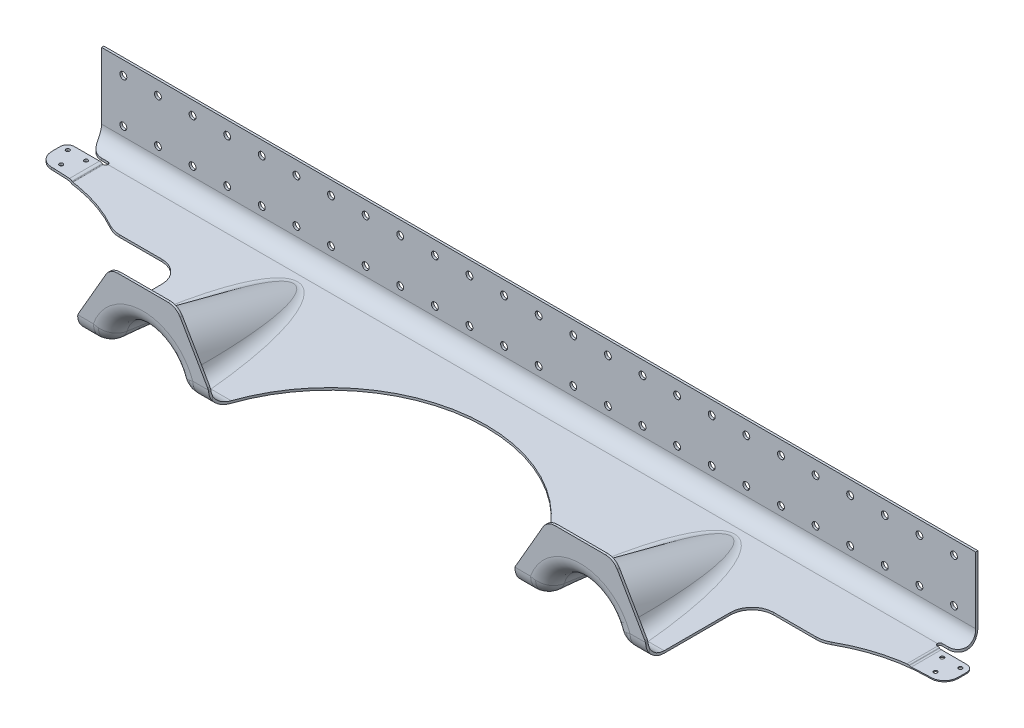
SolidWorks part; units mm, degrees
ref_plane "Front Plane" through (0, 0, 0) normal (1, 0, 0) x (0, 1, 0)
ref_plane "Top Plane" through (0, 0, 0) normal (0, 0, 1) x (0, 1, 0)
ref_plane "Right Plane" through (0, 0, 0) normal (0, 1, 0) x (-1, 0, 0)
sketch "sk 5dia hole pat" plane through (0, 0, 0) normal (0, 0, 1) x (0, 1, 0)
  line L4 (-30.48, -48.26) -> (30.48, -48.26) construction
  point P3 (0, -48.26)
  circle B0 centre (30.48, -579.12) radius 4.826
  circle B1 centre (1188.72, 579.12) radius 4.826
  circle B2 centre (78.74, -579.12) radius 4.826
  circle B3 centre (127, -579.12) radius 4.826
  circle B4 centre (175.26, -579.12) radius 4.826
  circle B5 centre (223.52, -579.12) radius 4.826
  circle B6 centre (271.78, -579.12) radius 4.826
  circle B7 centre (320.04, -579.12) radius 4.826
  circle B8 centre (368.3, -579.12) radius 4.826
  circle B9 centre (416.56, -579.12) radius 4.826
  circle B10 centre (464.82, -579.12) radius 4.826
  circle B11 centre (513.08, -579.12) radius 4.826
  circle B12 centre (561.34, -579.12) radius 4.826
  circle B13 centre (609.6, -579.12) radius 4.826
  circle B14 centre (657.86, -579.12) radius 4.826
  circle B15 centre (706.12, -579.12) radius 4.826
  circle B16 centre (754.38, -579.12) radius 4.826
  circle B17 centre (802.64, -579.12) radius 4.826
  circle B18 centre (850.9, -579.12) radius 4.826
  circle B19 centre (899.16, -579.12) radius 4.826
  circle B20 centre (947.42, -579.12) radius 4.826
  circle B21 centre (995.68, -579.12) radius 4.826
  circle B22 centre (1043.94, -579.12) radius 4.826
  circle B23 centre (1092.2, -579.12) radius 4.826
  circle B24 centre (1140.46, -579.12) radius 4.826
  circle B25 centre (1188.72, -579.12) radius 4.826
  circle B26 centre (30.48, -530.86) radius 4.826
  circle B27 centre (30.48, -482.6) radius 4.826
  circle B28 centre (30.48, -434.34) radius 4.826
  circle B29 centre (30.48, -386.08) radius 4.826
  circle B30 centre (30.48, -337.82) radius 4.826
  circle B31 centre (30.48, -289.56) radius 4.826
  circle B32 centre (30.48, -241.3) radius 4.826
  circle B33 centre (30.48, -193.04) radius 4.826
  circle B34 centre (30.48, -144.78) radius 4.826
  circle B35 centre (30.48, -96.52) radius 4.826
  circle B36 centre (30.48, -48.26) radius 4.826
  circle B37 centre (30.48, 0) radius 4.826
  circle B38 centre (30.48, 48.26) radius 4.826
  circle B39 centre (30.48, 96.52) radius 4.826
  circle B40 centre (30.48, 144.78) radius 4.826
  circle B41 centre (30.48, 193.04) radius 4.826
  circle B42 centre (30.48, 241.3) radius 4.826
  circle B43 centre (30.48, 289.56) radius 4.826
  circle B44 centre (30.48, 337.82) radius 4.826
  circle B45 centre (30.48, 386.08) radius 4.826
  circle B46 centre (30.48, 434.34) radius 4.826
  circle B47 centre (30.48, 482.6) radius 4.826
  circle B48 centre (30.48, 530.86) radius 4.826
  circle B49 centre (30.48, 579.12) radius 4.826
  circle B50 centre (1140.46, 579.12) radius 4.826
  circle B51 centre (1092.2, 579.12) radius 4.826
  circle B52 centre (1043.94, 579.12) radius 4.826
  circle B53 centre (995.68, 579.12) radius 4.826
  circle B54 centre (947.42, 579.12) radius 4.826
  circle B55 centre (899.16, 579.12) radius 4.826
  circle B56 centre (850.9, 579.12) radius 4.826
  circle B57 centre (802.64, 579.12) radius 4.826
  circle B58 centre (754.38, 579.12) radius 4.826
  circle B59 centre (706.12, 579.12) radius 4.826
  circle B60 centre (657.86, 579.12) radius 4.826
  circle B61 centre (609.6, 579.12) radius 4.826
  circle B62 centre (561.34, 579.12) radius 4.826
  circle B63 centre (513.08, 579.12) radius 4.826
  circle B64 centre (464.82, 579.12) radius 4.826
  circle B65 centre (416.56, 579.12) radius 4.826
  circle B66 centre (368.3, 579.12) radius 4.826
  circle B67 centre (320.04, 579.12) radius 4.826
  circle B68 centre (271.78, 579.12) radius 4.826
  circle B69 centre (223.52, 579.12) radius 4.826
  circle B70 centre (175.26, 579.12) radius 4.826
  circle B71 centre (127, 579.12) radius 4.826
  circle B72 centre (78.74, 579.12) radius 4.826
  circle B73 centre (1188.72, 530.86) radius 4.826
  circle B74 centre (1188.72, 482.6) radius 4.826
  circle B75 centre (1188.72, 434.34) radius 4.826
  circle B76 centre (1188.72, 386.08) radius 4.826
  circle B77 centre (1188.72, 337.82) radius 4.826
  circle B78 centre (1188.72, 289.56) radius 4.826
  circle B79 centre (1188.72, 241.3) radius 4.826
  circle B80 centre (1188.72, 193.04) radius 4.826
  circle B81 centre (1188.72, 144.78) radius 4.826
  circle B82 centre (1188.72, 96.52) radius 4.826
  circle B83 centre (1188.72, 48.26) radius 4.826
  circle B84 centre (1188.72, 0) radius 4.826
  circle B85 centre (1188.72, -48.26) radius 4.826
  circle B86 centre (1188.72, -96.52) radius 4.826
  circle B87 centre (1188.72, -144.78) radius 4.826
  circle B88 centre (1188.72, -193.04) radius 4.826
  circle B89 centre (1188.72, -241.3) radius 4.826
  circle B90 centre (1188.72, -289.56) radius 4.826
  circle B91 centre (1188.72, -337.82) radius 4.826
  circle B92 centre (1188.72, -386.08) radius 4.826
  circle B93 centre (1188.72, -434.34) radius 4.826
  circle B94 centre (1188.72, -482.6) radius 4.826
  circle B95 centre (1188.72, -530.86) radius 4.826
  line B96 (609.6, -579.12) -> (609.6, -504.12) construction
  line B97 (30.48, 0) -> (105.48, 0) construction
  circle B98 centre (-30.48, 579.12) radius 4.826
  circle B99 centre (-175.26, -579.12) radius 4.826
  circle B100 centre (-127, -579.12) radius 4.826
  circle B101 centre (-30.48, -579.12) radius 4.826
  circle B102 centre (-1188.72, 96.52) radius 4.826
  circle B103 centre (-127, 579.12) radius 4.826
  circle B104 centre (-464.82, 579.12) radius 4.826
  circle B105 centre (-513.08, 579.12) radius 4.826
  circle B106 centre (-706.12, 579.12) radius 4.826
  circle B107 centre (-754.38, 579.12) radius 4.826
  circle B108 centre (-899.16, 579.12) radius 4.826
  circle B109 centre (-30.48, 530.86) radius 4.826
  circle B110 centre (-30.48, 482.6) radius 4.826
  circle B111 centre (-30.48, 434.34) radius 4.826
  circle B112 centre (-30.48, 386.08) radius 4.826
  circle B113 centre (-30.48, 337.82) radius 4.826
  circle B114 centre (-30.48, 289.56) radius 4.826
  circle B115 centre (-30.48, 241.3) radius 4.826
  circle B116 centre (-30.48, 193.04) radius 4.826
  circle B117 centre (-30.48, 144.78) radius 4.826
  circle B118 centre (-30.48, 96.52) radius 4.826
  circle B119 centre (-30.48, 48.26) radius 4.826
  circle B120 centre (-30.48, 0) radius 4.826
  circle B121 centre (-30.48, -48.26) radius 4.826
  circle B122 centre (-30.48, -96.52) radius 4.826
  circle B123 centre (-30.48, -144.78) radius 4.826
  circle B124 centre (-30.48, -241.3) radius 4.826
  circle B125 centre (-30.48, -289.56) radius 4.826
  circle B126 centre (-30.48, -337.82) radius 4.826
  circle B127 centre (-30.48, -386.08) radius 4.826
  circle B128 centre (-30.48, -434.34) radius 4.826
  circle B129 centre (-30.48, -482.6) radius 4.826
  circle B130 centre (-30.48, -530.86) radius 4.826
  line B131 (-1188.72, 0) -> (-1113.72, 0) construction
  dimension "D1" = 60.96
sketch_block_instance "5dia hole pat-1"
sketch_block "5dia hole pat" parameters "D1"=9.652, "D2"=9.652, "D3"=75
sketch_block_instance "5dia hole pat-2"
sketch "sk 47.986in pnl" plane through (0, 0, 0) normal (0, 0, 1) x (0, 1, 0)
  line B0 (0.1778, 0) -> (1219.0222, 0) construction
  line B1 (0.1778, 609.4222) -> (1219.0222, 609.4222)
  line B2 (0.1778, 609.4222) -> (0.1778, -609.4222)
  line B3 (0.1778, -609.4222) -> (1219.0222, -609.4222)
  line B4 (1219.0222, 609.4222) -> (1219.0222, -609.4222)
  line B5 (609.6, 609.4222) -> (609.6, -609.4222) construction
  dimension "D1" = 30.3022
sketch_block_instance "47.986in pnl-1"
sketch_block "47.986in pnl" parameters "D1"=1218.8444, "D2"=1218.8444
sketch "sk main body" plane through (0, 0, 0) normal (1, 0, 0) x (0, 1, 0)
  line L0 (49.53, 0) -> (-43.18, 0)
  line L1 (-68.58, 25.4) -> (-68.58, 224.6)
  line L2 (-43.18, 250) -> (34.925, 250)
  line L3 (-26.67, 279.6901) -> (-26.67, 213.0698) construction
  line L4 (49.53, 3.175) -> (-43.18, 3.175)
  line L5 (-65.405, 25.4) -> (-65.405, 224.6)
  line L6 (-43.18, 246.825) -> (34.925, 246.825)
  line L7 (34.925, 250) -> (34.925, 246.825)
  line L8 (49.53, 3.175) -> (49.53, 0)
  line L9 (55, 0) -> (-55, 0) construction
  arc A0 (-43.18, 0) -> (-68.58, 25.4) centre (-43.18, 25.4) cw
  arc A1 (-68.58, 224.6) -> (-43.18, 250) centre (-43.18, 224.6) cw
  arc A2 (-43.18, 3.175) -> (-65.405, 25.4) centre (-43.18, 25.4) cw
  arc A3 (-65.405, 224.6) -> (-43.18, 246.825) centre (-43.18, 224.6) cw
  dimension "D2" = 25.4
  dimension "D1" = 19.05
  dimension "D3" = 12.7
  dimension "D4" = 16.51
  dimension "D5" = 61.595
  dimension "D7" = 243.65
  dimension "D6" = 3.175
extrude "main body" add sketch "sk main body" along normal mid plane 1218.8444
sketch "sk upper holes" plane through (0, 0, 250) normal (0, 0, 1) x (1, 0, 0)
  line L0 (-609.4222, 0.1778) -> (-609.4222, 1219.0222) construction
  line L1 (609.4222, 0.1778) -> (609.4222, 1219.0222) construction
  line L2 (609.4222, 34.925) -> (-609.4222, 34.925) construction
  circle A2 centre (-342.9, 15.875) radius 16.51 construction
  circle A3 centre (-266.7, 15.875) radius 16.51 construction
  circle A4 centre (266.7, 15.875) radius 16.51 construction
  circle A5 centre (342.9, 15.875) radius 16.51 construction
  line B0 (-342.9, 15.875) -> (-266.7, 15.875) construction
  circle B1 centre (-342.9, 15.875) radius 7.1438
  circle B2 centre (-266.7, 15.875) radius 7.1438
  line B3 (266.7, 15.875) -> (342.9, 15.875) construction
  circle B4 centre (266.7, 15.875) radius 7.1438
  circle B5 centre (342.9, 15.875) radius 7.1438
  dimension "D1" = 304.8
  dimension "D2" = 304.8
  dimension "D6" = 33.02
  dimension "D7" = 33.02
  dimension "D8" = 33.02
  dimension "D9" = 33.02
  dimension "D3" = 304.6222
  dimension "D4" = 304.6222
  dimension "D5" = 19.05
sketch_block_instance "Upper bolt holes-1"
sketch_block "Upper bolt holes" parameters "D1"=14.2875, "D2"=14.2875, "D3"=76.2
sketch_block_instance "Upper bolt holes-2"
sketch "Sketch6" plane through (0, 0, 250) normal (0, 0, 1) x (1, 0, 0)
  line L0 (-396.0595, -43.18) -> (-304.8, 114.8861)
  line L1 (609.4222, -43.18) -> (-609.4222, -43.18) construction
  line L2 (-304.8, 114.8861) -> (-213.5405, -43.18)
  line L3 (-396.0595, -43.18) -> (-638.8127, -43.18)
  line L4 (-638.8127, -43.18) -> (-638.8127, 115.8831)
  line L6 (213.5405, -43.18) -> (304.8, 114.8861)
  line L7 (304.8, 114.8861) -> (396.0595, -43.18)
  line L8 (396.0595, -43.18) -> (645.1619, -43.18)
  line L9 (645.1619, -43.18) -> (645.1619, 115.8831)
  line L10 (-213.5405, -43.18) -> (213.5405, -43.18)
  line L11 (-638.8127, 115.8831) -> (645.1619, 115.8831)
  circle A0 centre (-342.9, 15.875) radius 16.51 construction
  circle A1 centre (-266.7, 15.875) radius 16.51 construction
  circle A2 centre (342.9, 15.875) radius 16.51 construction
  circle A3 centre (266.7, 15.875) radius 16.51 construction
  point P15 (0, 0)
  dimension "D1" = 60
  dimension "D2" = 60
  dimension "D3" = 60
  dimension "D4" = 60
extrude "Upper tabs" cut sketch "Sketch6" against normal blind 10
sketch "Sketch7" plane through (0, 0, 0) normal (0, 1, 0) x (-1, 0, 0)
  line L0 (-213.5405, 246.825) -> (-213.5405, 277.059)
  line L4 (-213.5405, 277.059) -> (213.5405, 277.059)
  line L5 (213.5405, 277.059) -> (213.5405, 246.825)
  line L6 (-609.4222, 25.4) -> (609.4222, 25.4) construction
  arc A2 (-213.5405, 246.825) -> (213.5405, 246.825) centre (0, 295.1375) ccw
  point P2 (0, 76.2)
  dimension "D1" = 50.8
extrude "Side Mid curve" cut sketch "Sketch7" against normal through all
sketch "5dia hole for part" plane through (0, 0, 0) normal (0, 0, 1) x (0, 1, 0)
  circle A0 centre (-30.48, -579.12) radius 4.826
  circle A1 centre (30.48, -579.12) radius 4.826
  circle A2 centre (-30.48, -579.12) radius 4.826 construction
  circle A3 centre (30.48, -579.12) radius 4.826 construction
  circle A4 centre (-30.48, -530.86) radius 4.826
  circle A5 centre (30.48, -530.86) radius 4.826
  circle A6 centre (-30.48, -482.6) radius 4.826
  circle A7 centre (30.48, -482.6) radius 4.826
  circle A8 centre (-30.48, -434.34) radius 4.826
  circle A9 centre (30.48, -434.34) radius 4.826
  circle A10 centre (-30.48, -386.08) radius 4.826
  circle A11 centre (30.48, -386.08) radius 4.826
  circle A12 centre (-30.48, -337.82) radius 4.826
  circle A13 centre (30.48, -337.82) radius 4.826
  circle A14 centre (-30.48, -289.56) radius 4.826
  circle A15 centre (30.48, -289.56) radius 4.826
  circle A16 centre (-30.48, -241.3) radius 4.826
  circle A17 centre (30.48, -241.3) radius 4.826
  circle A18 centre (-30.48, -193.04) radius 4.826
  circle A19 centre (30.48, -193.04) radius 4.826
  circle A20 centre (-30.48, -144.78) radius 4.826
  circle A21 centre (30.48, -144.78) radius 4.826
  circle A22 centre (-30.48, -96.52) radius 4.826
  circle A23 centre (30.48, -96.52) radius 4.826
  circle A24 centre (-30.48, -48.26) radius 4.826
  circle A25 centre (30.48, -48.26) radius 4.826
  circle A26 centre (-30.48, 0) radius 4.826
  circle A27 centre (30.48, 0) radius 4.826
  circle A28 centre (-30.48, 48.26) radius 4.826
  circle A29 centre (30.48, 48.26) radius 4.826
  circle A30 centre (-30.48, 96.52) radius 4.826
  circle A31 centre (30.48, 96.52) radius 4.826
  circle A32 centre (-30.48, 144.78) radius 4.826
  circle A33 centre (30.48, 144.78) radius 4.826
  circle A34 centre (-30.48, 193.04) radius 4.826
  circle A35 centre (30.48, 193.04) radius 4.826
  circle A36 centre (-30.48, 241.3) radius 4.826
  circle A37 centre (30.48, 241.3) radius 4.826
  circle A38 centre (-30.48, 289.56) radius 4.826
  circle A39 centre (30.48, 289.56) radius 4.826
  circle A40 centre (-30.48, 337.82) radius 4.826
  circle A41 centre (30.48, 337.82) radius 4.826
  circle A42 centre (-30.48, 386.08) radius 4.826
  circle A43 centre (30.48, 386.08) radius 4.826
  circle A44 centre (-30.48, 434.34) radius 4.826
  circle A45 centre (30.48, 434.34) radius 4.826
  circle A46 centre (-30.48, 482.6) radius 4.826
  circle A47 centre (30.48, 482.6) radius 4.826
  circle A48 centre (-30.48, 530.86) radius 4.826
  circle A49 centre (30.48, 530.86) radius 4.826
  circle A50 centre (-30.48, 579.12) radius 4.826
  circle A51 centre (30.48, 579.12) radius 4.826
  dimension "D1" = 25
extrude "Holes Bot" cut sketch "5dia hole for part" along normal blind 10
extrude "Holes Top" [suppressed] cut sketch "sk upper holes" against normal blind 10
ref_plane "Tab Lower pln" through (0, 0, 25.4) normal (0, 0, 1) x (0, 1, 0)
sketch "sk Rivet holes" plane through (0, 0, 0) normal (0, 1, 0) x (-1, 0, 0)
  line L1 (609.4222, 0) -> (609.4222, 3.175) construction
  line L3 (64.9605, 25.4) -> (-64.9605, 25.4) construction
  line L5 (-609.4222, 25.4) -> (-609.4222, 224.6) construction
  circle A0 centre (622.3, 37.4) radius 10 construction
  circle A1 centre (609.6, 59.397) radius 10 construction
  circle A2 centre (596.9, 37.4) radius 10 construction
  circle A3 centre (-609.6, 59.397) radius 10 construction
  circle A4 centre (-596.9, 37.4) radius 10 construction
  circle A6 centre (-622.3, 37.4) radius 10 construction
  point P5 (622.3, 34.8092)
  point P9 (622.3, 27.4)
  point P20 (632.3, 37.4)
  point P21 (-632.3, 37.4)
  point P22 (586.9, 37.4)
  point P23 (-586.9, 37.4)
  point P24 (609.6, 69.397)
  point P25 (-609.6, 69.397)
  line B0 (596.9, 37.4) -> (609.6, 59.397) construction
  line B1 (609.6, 59.397) -> (622.3, 37.4) construction
  line B2 (622.3, 37.4) -> (596.9, 37.4) construction
  circle B3 centre (596.9, 37.4) radius 2.5908
  circle B4 centre (622.3, 37.4) radius 2.5908
  circle B5 centre (609.6, 59.397) radius 2.5908
  line B6 (603.25, 48.3985) -> (609.6, 44.7323) construction
  line B7 (609.6, 37.4) -> (609.6, 44.7323) construction
  line B8 (-622.3, 37.4) -> (-609.6, 59.397) construction
  line B9 (-609.6, 59.397) -> (-596.9, 37.4) construction
  line B10 (-596.9, 37.4) -> (-622.3, 37.4) construction
  circle B11 centre (-622.3, 37.4) radius 2.5908
  circle B12 centre (-596.9, 37.4) radius 2.5908
  circle B13 centre (-609.6, 59.397) radius 2.5908
  line B14 (-615.95, 48.3985) -> (-609.6, 44.7323) construction
  line B15 (-609.6, 37.4) -> (-609.6, 44.7323) construction
  dimension "D4" = 20
  dimension "D6" = 20
  dimension "D7" = 20
  dimension "D8" = 20
  dimension "D9" = 20
  dimension "D10" = 20
  dimension "D1" = 0.1778
  dimension "D2" = 12
  dimension "D3" = 0.1778
  dimension "D5" = 7.4092
sketch_block_instance "Blind Rivet holes-1"
sketch_block "Blind Rivet holes" parameters "D1"=5.1816, "D2"=5.1816, "D3"=5.1816, "D4"=60, "D5"=60, "D6"=25.4, "D7"=25.4, "D8"=25.4
sketch_block_instance "Blind Rivet holes-2"
sketch "sk Vtab" plane through (0, 0, 25.4) normal (0, 0, 1) x (0, 1, 0)
  line L8 (-68.58, -609.4222) -> (-68.58, 609.4222) construction
  line B0 (-68.58, 579.4709) -> (-68.58, 581.4709)
  line B1 (-67.9101, 583.9709) -> (-67.6624, 584.4)
  line B2 (-66.9925, 586.9) -> (-66.9925, 631.9)
  line B3 (-65.405, 579.4709) -> (-65.405, 581.4709)
  line B4 (-65.1605, 582.3834) -> (-64.9127, 582.8125)
  line B5 (-63.8175, 586.9) -> (-63.8175, 631.9)
  line B6 (-68.58, 579.4709) -> (-65.405, 579.4709)
  line B7 (-63.8175, 631.9) -> (-66.9925, 631.9)
  arc B8 (-67.6624, 584.4) -> (-66.9925, 586.9) centre (-71.9925, 586.9) ccw
  arc B9 (-68.58, 581.4709) -> (-67.9101, 583.9709) centre (-63.58, 581.4709) cw
  arc B10 (-65.405, 581.4709) -> (-65.1605, 582.3834) centre (-63.58, 581.4709) cw
  arc B11 (-64.9127, 582.8125) -> (-63.8175, 586.9) centre (-71.9925, 586.9) ccw
  line B12 (-65.405, -579.4709) -> (-65.405, -581.4709)
  line B13 (-66.0749, -583.9709) -> (-66.3226, -584.4)
  line B14 (-66.9925, -586.9) -> (-66.9925, -631.9)
  line B15 (-68.58, -579.4709) -> (-68.58, -581.4709)
  line B16 (-68.8245, -582.3834) -> (-69.0723, -582.8125)
  line B17 (-70.1675, -586.9) -> (-70.1675, -631.9)
  line B18 (-65.405, -579.4709) -> (-68.58, -579.4709)
  line B19 (-70.1675, -631.9) -> (-66.9925, -631.9)
  arc B20 (-66.3226, -584.4) -> (-66.9925, -586.9) centre (-61.9925, -586.9) ccw
  arc B21 (-65.405, -581.4709) -> (-66.0749, -583.9709) centre (-70.405, -581.4709) cw
  arc B22 (-68.58, -581.4709) -> (-68.8245, -582.3834) centre (-70.405, -581.4709) cw
  arc B23 (-69.0723, -582.8125) -> (-70.1675, -586.9) centre (-61.9925, -586.9) ccw
sketch_block_instance "V tab-1"
sketch_block "V tab" parameters "D3"=5, "D1"=30, "D2"=1.5875, "D4"=2, "D5"=24.625
sketch_block_instance "V tab-2"
sketch "sk Vtab precut" plane through (0, 0, 25.4) normal (0, 0, 1) x (0, 1, 0)
  line L1 (-68.58, 581.4709) -> (-25.5629, 581.4709)
  line L2 (-68.58, 581.4709) -> (-68.58, 628.7058)
  line L3 (-68.58, 628.7058) -> (-25.5629, 628.7058)
  line L4 (-25.5629, 581.4709) -> (-25.5629, 628.7058)
  line L5 (-68.58, -581.4709) -> (-35.8904, -581.4709)
  line L6 (-68.58, -581.4709) -> (-68.58, -622.8382)
  line L7 (-68.58, -622.8382) -> (-35.8904, -622.8382)
  line L8 (-35.8904, -581.4709) -> (-35.8904, -622.8382)
sketch "Sketch9" plane through (0, 0, 0) normal (0, 1, 0) x (-1, 0, 0)
  line L6 (396.0595, 246.825) -> (396.0595, 288.5559)
  line L7 (396.0595, 288.5559) -> (646.1786, 288.5559)
  line L8 (646.1786, 288.5559) -> (646.1786, 69.397)
  line L9 (646.1786, 69.397) -> (609.6, 69.397)
  line L10 (-396.0595, 246.825) -> (-396.0595, 291.6094)
  line L11 (-396.0595, 291.6094) -> (-686.7988, 291.6094)
  line L12 (-686.7988, 291.6094) -> (-686.7988, 69.397)
  line L13 (-686.7988, 69.397) -> (-609.6, 69.397)
  arc A2 (396.0595, 246.825) -> (609.6, 69.397) centre (609.6, 286.6126) ccw
  arc A3 (-396.0595, 246.825) -> (-609.6, 69.397) centre (-609.6, 286.6126) cw
  circle A4 centre (-609.6, 59.397) radius 10 construction
extrude "Cut-Extrude5" cut sketch "sk Vtab precut" along normal through all
extrude "Side Tabs" add sketch "sk Vtab" along normal blind 50
sketch "Sketch11" plane through (0, 0, 0) normal (0, 1, 0) x (-1, 0, 0)
  line L0 (581.4709, 25.4) -> (667.6325, 25.4) construction
  line L1 (581.4709, 28.575) -> (667.6325, 28.575)
  line L2 (581.4709, 22.225) -> (667.6325, 22.225)
  line L4 (-581.4709, 25.4) -> (581.4709, 25.4) construction
  line L5 (581.4709, 75.4) -> (581.4709, 25.4) construction
  line L6 (-581.4709, 25.4) -> (-658.6998, 25.4) construction
  line L7 (-581.4709, 22.225) -> (-658.6998, 22.225)
  line L8 (-581.4709, 28.575) -> (-658.6998, 28.575)
  line L9 (-581.4709, 25.4) -> (-581.4709, 75.4) construction
  arc A0 (581.4709, 28.575) -> (581.4709, 22.225) centre (581.4709, 25.4) ccw
  arc A1 (667.6325, 22.225) -> (667.6325, 28.575) centre (667.6325, 25.4) ccw
  arc A2 (-581.4709, 22.225) -> (-581.4709, 28.575) centre (-581.4709, 25.4) ccw
  arc A3 (-658.6998, 28.575) -> (-658.6998, 22.225) centre (-658.6998, 25.4) ccw
  point P2 (624.5517, 25.4)
  point P7 (-620.0853, 25.4)
  dimension "D1" = 3.175
  dimension "D2" = 3.175
extrude "tab undercut" cut sketch "Sketch11" against normal through all
extrude "Outer curve cut" cut sketch "Sketch9" against normal through all
fillet "Fillet1" radius 19.05 12 edges at (-609.4222, -66.7789, 22.225) (609.4222, -66.7789, 22.225) (631.9, -68.58, 69.397) (-631.9, -65.405, 69.397) (-396.0595, -49.3284, 246.825) (-213.5405, -49.3284, 246.825) (396.0595, -49.3284, 246.825) (213.5405, -49.3284, 246.825) (350.9656, 34.925, 248.4125) (258.6344, 34.925, 248.4125) (-258.6344, 34.925, 248.4125) (-350.9656, 34.925, 248.4125)
fillet "Fillet3" radius 9.525 10 edges at (631.9, -68.58, 28.575) (-631.9, -65.405, 28.575) (213.5092, -43.2341, 247.9113) (396.0809, -43.217, 247.7239) (-213.5092, -43.2341, 247.9113) (-396.0809, -43.217, 247.7239) (396.0595, -43.18, 249.3127) (-396.0595, -43.18, 249.3127) (213.5405, -43.18, 249.5011) (-213.5405, -43.18, 249.5011)
extrude "Tab Holes" cut sketch "sk Rivet holes" against normal through all
sketch "Collar Interferance" plane through (0, 0, 0) normal (0, 1, 0) x (-1, 0, 0)
  line L0 (356.4648, 250) -> (356.4648, 246.825) construction
  line L1 (406.4, 281.3006) -> (718.4077, 281.3006)
  line L2 (406.4, 281.3006) -> (406.4, 112)
  line L3 (406.4, 112) -> (718.4077, 112)
  line L4 (718.4077, 281.3006) -> (718.4077, 112)
  line L5 (-609.4222, 0) -> (609.4222, 0) construction
  line L6 (-356.4648, 246.825) -> (-356.4648, 250) construction
  line L7 (-700.5611, 281.3006) -> (-406.4, 281.3006)
  line L8 (-700.5611, 281.3006) -> (-700.5611, 112)
  line L9 (-700.5611, 112) -> (-406.4, 112)
  line L10 (-406.4, 281.3006) -> (-406.4, 112)
  dimension "D1" = 49.9352
  dimension "D2" = 112
  dimension "D3" = 49.9352
sketch "Sketch13" plane through (0, 0, 0) normal (0, 1, 0) x (-1, 0, 0)
  line L14 (-396.4, 291.3006) -> (-710.5611, 291.3006)
  line L15 (-396.4, 102) -> (-396.4, 291.3006)
  line L16 (-710.5611, 102) -> (-396.4, 102)
  line L17 (-710.5611, 291.3006) -> (-710.5611, 102)
  line L18 (-396.4, 291.3006) -> (-710.5611, 291.3006)
  line L19 (-396.4, 132) -> (-396.4, 291.3006)
  line L20 (-710.5611, 102) -> (-426.4, 102)
  line L21 (-710.5611, 291.3006) -> (-710.5611, 102)
  line L26 (728.4077, 291.3006) -> (396.4, 291.3006)
  line L27 (728.4077, 102) -> (728.4077, 291.3006)
  line L28 (396.4, 102) -> (728.4077, 102)
  line L29 (396.4, 291.3006) -> (396.4, 102)
  line L30 (728.4077, 291.3006) -> (396.4, 291.3006)
  line L31 (728.4077, 102) -> (728.4077, 291.3006)
  line L32 (426.4, 102) -> (728.4077, 102)
  line L33 (396.4, 291.3006) -> (396.4, 132)
  arc A0 (426.4, 102) -> (396.4, 132) centre (426.4, 132) cw
  arc A1 (-396.4, 132) -> (-426.4, 102) centre (-426.4, 132) cw
  dimension "D3" = 30
  dimension "D1" = 10
  dimension "D2" = 10
extrude "Cut-Extrude6" cut sketch "Sketch13" against normal through all both and the other way through all
fillet "Fillet4" radius 35 2 edges at (-495.1413, -66.9925, 102) (495.1413, -66.9925, 102)
sketch "Sketch14" plane through (0, 0, 250) normal (0, 0, 1) x (1, 0, 0)
  line L0 (-304.8, -9.525) -> (304.8, -9.525)
  line L1 (-269.6329, 34.925) -> (-339.9671, 34.925) construction
  line L2 (339.9671, 34.925) -> (269.6329, 34.925) construction
  point P3 (-304.8, 34.925)
  point P7 (304.8, 34.925)
  point P8 (304.8, -9.525)
  point P11 (-304.8, -9.525)
  dimension "D1" = 44.45
sketch "Sketch15" plane through (0, 0, 0) normal (1, 0, 0) x (0, 1, 0)
  line L0 (-9.525, 250) -> (-68.58, 25.4)
  line L1 (-9.525, 250) -> (-23.3909, 253.6458)
  point P3 (-23.3909, 253.6458)
  point P5 (-9.525, 250)
ref_plane "Plane1" through (0, 60.867, 231.4915) normal (0, 0.2543, 0.9671) x (0, -0.9671, 0.2543)
sketch "Sketch16" plane through (0, 60.867, 231.4915) normal (0, 0.2543, 0.9671) x (0, -0.9671, 0.2543)
  line L0 (72.7846, -304.8) -> (72.7846, 304.8) construction
  line L1 (124.2743, 209.3504) -> (124.2743, 396.4) construction
  line L2 (124.2743, -396.4) -> (124.2743, -209.3504) construction
  circle A0 centre (124.2743, 304.8) radius 51.4897
  circle A1 centre (124.2743, -304.8) radius 51.4897
sketch "Sketch17" plane through (0, 60.867, 231.4915) normal (0, 0.2543, 0.9671) x (0, -0.9671, 0.2543)
  line L0 (124.2743, -253.3103) -> (124.2743, -256.4853)
  line L1 (124.2743, 256.4853) -> (124.2743, 253.3103)
  line L2 (124.2743, 356.2897) -> (124.2743, 353.1147)
  line L3 (124.2743, -396.4) -> (124.2743, -209.3504) construction
  line L4 (124.2743, -353.1147) -> (124.2743, -356.2897)
  arc A0 (124.2743, 356.2897) -> (124.2743, 253.3103) centre (124.2743, 304.8) ccw
  arc A1 (124.2743, -253.3103) -> (124.2743, -356.2897) centre (124.2743, -304.8) ccw
  circle A2 centre (124.2743, -304.8) radius 51.4897 construction
  circle A3 centre (124.2743, 304.8) radius 51.4897 construction
  arc A4 (124.2743, 353.1147) -> (124.2743, 256.4853) centre (124.2743, 304.8) ccw
  arc A5 (124.2743, -256.4853) -> (124.2743, -353.1147) centre (124.2743, -304.8) ccw
  arc A6 (124.2743, 356.2897) -> (119.7057, 253.5134) centre (124.2743, 304.8) ccw construction
  arc A7 (124.2743, 353.1147) -> (119.9874, 256.6759) centre (124.2743, 304.8) ccw construction
  dimension "D1" = 3.175
extrude "Cut-Extrude7" cut sketch "Sketch16" against normal through all
extrude "Boss-Extrude1" add sketch "Sketch17" against normal through all
sketch "Sketch18" plane through (0, 0, 0) normal (1, 0, 0) x (0, 1, 0)
  line L0 (34.6982, 250) -> (-43.18, 250)
  line L1 (-68.58, 224.6) -> (-68.58, 25.4)
  line L2 (-43.18, 0) -> (-29.8301, 0)
  line L3 (-29.8301, 0) -> (-29.8301, -41.1008)
  line L4 (-29.8301, -41.1008) -> (-144.5548, -41.1008)
  line L5 (-144.5548, -41.1008) -> (-144.5548, 281.4583)
  line L6 (-144.5548, 281.4583) -> (34.6982, 281.4583)
  line L7 (34.6982, 281.4583) -> (34.6982, 250)
  line L8 (-43.18, 0) -> (49.53, 0) construction
  line L9 (-68.58, 224.6) -> (-68.58, 25.4) construction
  line L10 (-9.525, 250) -> (-43.18, 250) construction
  arc A0 (-68.58, 25.4) -> (-43.18, 0) centre (-43.18, 25.4) ccw
  arc A1 (-43.18, 250) -> (-68.58, 224.6) centre (-43.18, 224.6) ccw
  dimension "D1" = 25.4
extrude "Cut-Extrude8" cut sketch "Sketch18" against normal through all both and the other way through all
fillet "Fillet5" radius 22.352 8 edges at (-355.6427, -56.3164, 242.5272) (-253.5603, -60.5615, 238.4505) (-304.8, -10.3598, 246.825) (253.9573, -56.3164, 242.5272) (356.0397, -60.5615, 238.4505) (304.8, -10.3598, 246.825) (-304.8, -65.405, 37.4753) (304.8, -65.405, 37.4753)
fillet "Fillet6" radius 25.527 8 edges at (-353.0654, -63.0157, 240.4652) (-256.8566, -57.8011, 245.3698) (-304.8, -12.8079, 250) (256.5346, -63.0157, 240.4652) (352.7434, -57.8011, 245.3698) (304.8, -12.8079, 250) (-304.8, -68.58, 37.8857) (304.8, -68.58, 37.8857)
equation "\"3i\"=138.375"
equation "\".75i\"=12.7"
